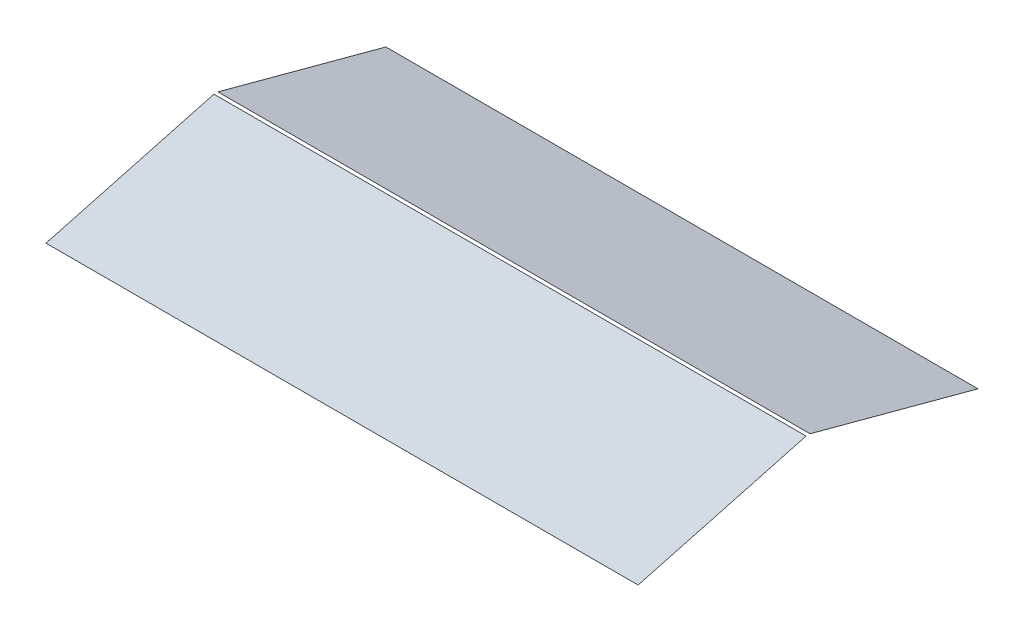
SolidWorks part; units mm, degrees
ref_plane "Front" through (0, 0, 0) normal (0, 0, 1) x (1, 0, 0)
ref_plane "Base Plane" through (0, 0, 0) normal (0, 1, 0) x (1, 0, 0)
ref_plane "Back Plane" through (0, 0, 0) normal (1, 0, 0) x (0, 0, -1)
other "Configuration Table"
sketch "Points Sketch" plane through (0, 0, 0) normal (0, 1, 0) x (1, 0, 0)
  point P0 (0, 0)
  point P3 (21000, 3000)
  point P4 (3000, 0)
  point P5 (21000, 9000)
  point P6 (6000, 0)
  point P7 (9000, 0)
  point P8 (12000, 0)
  point P9 (15000, 0)
  point P10 (18000, 0)
  point P11 (21000, 0)
  point P12 (6000, 3000)
  point P13 (9000, 3000)
  point P14 (12000, 3000)
  point P15 (15000, 3000)
  point P16 (18000, 3000)
  point P17 (3000, 9000)
  point P19 (3000, 6000)
  point P20 (6000, 6000)
  point P21 (9000, 6000)
  point P23 (12000, 6000)
  point P24 (15000, 6000)
  point P25 (18000, 6000)
  point P26 (21000, 6000)
  point P27 (6000, 9000)
  point P28 (9000, 9000)
  point P29 (12000, 9000)
  point P30 (15000, 9000)
  point P31 (18000, 9000)
  point P32 (0, 3000)
  point P35 (0, 6000)
  point P37 (0, 12000)
  point P38 (3000, 12000)
  point P39 (6000, 12000)
  point P40 (9000, 12000)
  point P41 (12000, 12000)
  point P42 (15000, 12000)
  point P43 (18000, 12000)
  point P44 (21000, 12000)
  point P45 (3000, 3000)
  point P46 (0, 9000)
  dimension "D1" = 8
  dimension "D2" = 5
ref_plane "Front plane" through (21000, 0, 0) normal (1, 0, 0) x (0, 0, -1)
sketch "Sketch15" plane through (0, 0, 0) normal (1, 0, 0) x (0, 0, -1)
  line L0 (0, 3500) -> (6000, 5107.6952)
  line L1 (6000, 5107.6952) -> (12000, 3500)
  line L2 (6000, 1650) -> (6000, -1650) construction
  line L3 (0, 50) -> (0, -50) construction
  dimension "D1" = 75
surface "Roof Surface 1" sketch "Sketch15"
sketch "Sketch124" plane through (21000, 0, 0) normal (1, 0, 0) x (0, 0, -1)
  line L0 (6000, 1650) -> (6000, -1650) construction
  line L1 (-120, 3557.977) -> (-120, 0) construction
  line L2 (-120, 3557.977) -> (5880, 5167.6952)
  line L3 (5880, 5214.4961) -> (5880, 5056.8765) construction
  line L4 (12120, 3557.977) -> (6120, 5167.6952)
  line L5 (6120, 5214.4961) -> (6120, 5056.8765) construction
  line L6 (5880, 5167.6952) -> (5928.2922, 5180.6513)
  line L7 (6120, 5167.6952) -> (6071.7078, 5180.6513)
  point P0 (-120, 3557.977)
  point P1 (6000, 5167.7)
  point P2 (6000, 0)
  dimension "D1" = 3560
  dimension "D2" = 5167.7
  dimension "D3" = 6120
  dimension "D4" = 120
  dimension "D5" = 120
  dimension "D6" = 60
  dimension "D7" = 60
  dimension "D8" = 50
  dimension "D9" = 50
surface "Roof Surface 2" sketch "Sketch124" parameters "D1"=21277, "D2"=50
ref_plane "Top plane" through (0, 3500, 0) normal (0, 1, 0) x (1, 0, 0)
ref_plane "Central Plane" through (0, 0, -6000) normal (0, 0, 1) x (1, 0, 0)
ref_plane "Summit Plane" through (0, 5107.6952, 0) normal (0, 1, 0) x (1, 0, 0)
sketch "Sketch3" plane through (0, 3500, 0) normal (0, 1, 0) x (1, 0, 0)
  point P0 (6000, 6000)
  point P2 (9000, 6000)
  point P4 (12000, 6000)
  point P6 (15000, 6000)
  point P8 (18000, 6000)
  point P10 (21000, 6000)
  point P12 (21000, 3000)
  point P14 (15000, 0)
  point P16 (18000, 0)
  point P18 (21000, 0)
  point P20 (12000, 0)
  point P22 (9000, 0)
  point P24 (6000, 0)
  point P26 (3000, 0)
  point P28 (0, 0)
  point P30 (0, 3000)
  point P32 (3000, 6000)
  point P34 (0, 6000)
  point P36 (0, 9000)
  point P38 (21000, 9000)
  point P40 (0, 12000)
  point P42 (3000, 12000)
  point P44 (6000, 12000)
  point P46 (9000, 12000)
  point P48 (12000, 12000)
  point P50 (15000, 12000)
  point P52 (18000, 12000)
  point P54 (21000, 12000)
ref_plane "V Intermediate Plane 1" through (18000, 0, 0) normal (1, 0, 0) x (0, 0, -1)
ref_plane "V Intermediate Plane 2" through (15000, 0, 0) normal (1, 0, 0) x (0, 0, -1)
ref_plane "V Intermediate Plane 3" through (12000, 0, 0) normal (1, 0, 0) x (0, 0, -1)
ref_plane "V Intermediate Plane 4" through (9000, 0, 0) normal (1, 0, 0) x (0, 0, -1)
ref_plane "V Intermediate Plane 5" through (6000, 0, 0) normal (1, 0, 0) x (0, 0, -1)
ref_plane "V Intermediate Plane 6" through (3000, 0, 0) normal (1, 0, 0) x (0, 0, -1)
ref_plane "H Intermediate Plane 1" through (0, 2400, 0) normal (0, 1, 0) x (1, 0, 0)
ref_plane "H Intermediate Plane 2" through (0, 1200, 0) normal (0, 1, 0) x (1, 0, 0)
